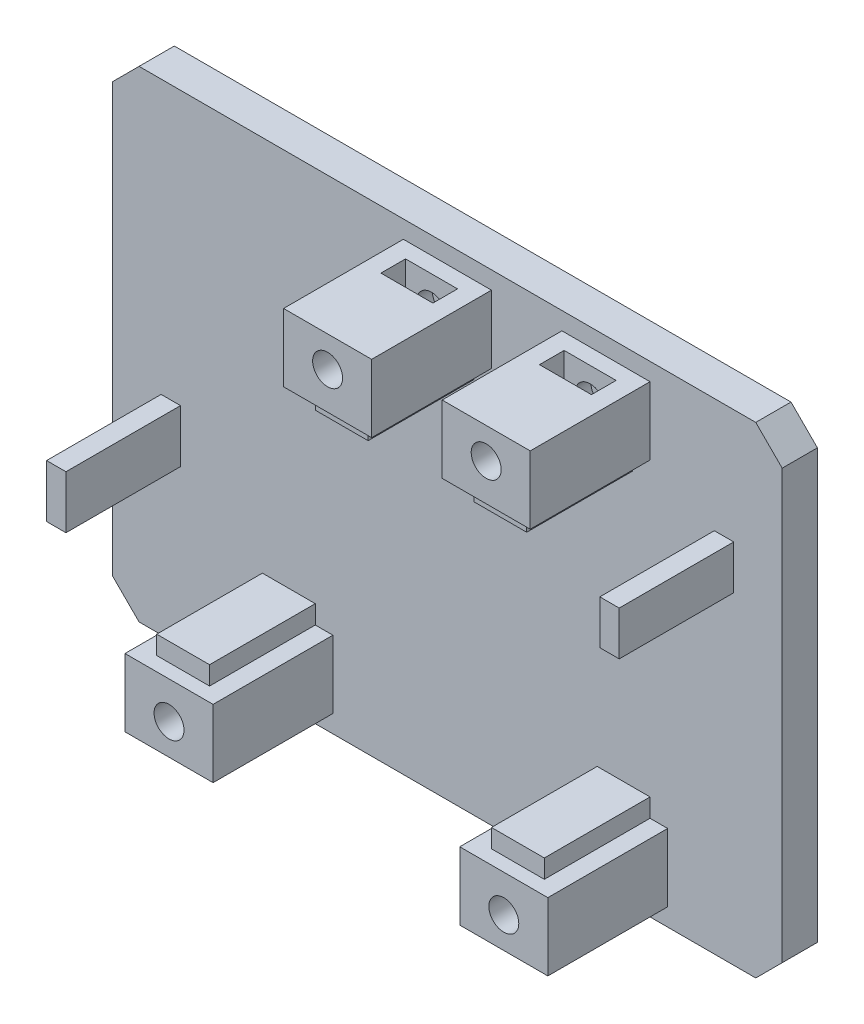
SolidWorks part; units mm, degrees
ref_plane "前视基准面" through (0, 0, 0) normal (0, 0, 1) x (1, 0, 0)
ref_plane "上视基准面" through (0, 0, 0) normal (0, 1, 0) x (1, 0, 0)
ref_plane "右视基准面" through (0, 0, 0) normal (1, 0, 0) x (0, 0, -1)
other "Configuration Table"
sketch "草图1" plane through (0, 0, 0) normal (0, 0, 1) x (1, 0, 0)
  line L0 (-5, -44.619) -> (65, -44.619)
  line L1 (65, -44.619) -> (68, -41.619)
  line L2 (68, -41.619) -> (68, 7)
  line L3 (68, 7) -> (65, 10)
  line L4 (65, 10) -> (-5, 10)
  line L5 (-5, 10) -> (-8, 7)
  line L6 (-8, 7) -> (-8, -41.619)
  line L7 (-8, -41.619) -> (-5, -44.619)
  dimension "D1" = 65
  dimension "D2" = 68
  dimension "D3" = 5
  dimension "D4" = 7
  dimension "D5" = 10
  dimension "D6" = 41.619
extrude "Flat_floor_4mm" add sketch "草图1" along normal blind 4
sketch "草图2" plane through (0, 0, 0) normal (0, 0, 1) x (1, 0, 0)
  line L0 (25, 0.3) -> (35, 0.3)
  line L1 (35, 0.3) -> (35, 8)
  line L2 (35, 8) -> (25, 8)
  line L3 (25, 8) -> (25, 0.3)
  circle A0 centre (30, 4.5) radius 1.7
  dimension "D1" = 3.4
  dimension "D2" = 25
  dimension "D3" = 30
  dimension "D4" = 35
  dimension "D5" = 0.3
  dimension "D6" = 4.5
  dimension "D7" = 8
extrude "Edge_pedestal_1_band_1" add sketch "草图2" along normal blind 1.8 from offset 4
sketch "草图3" plane through (0, 0, 0) normal (0, 0, 1) x (1, 0, 0)
  line L0 (25, 0.3) -> (35, 0.3)
  line L1 (35, 0.3) -> (35, 8)
  line L2 (35, 8) -> (32.95, 8)
  line L3 (32.95, 8) -> (32.95, 1)
  line L4 (32.95, 1) -> (27.05, 1)
  line L5 (27.05, 1) -> (27.05, 8)
  line L6 (27.05, 8) -> (25, 8)
  line L7 (25, 8) -> (25, 0.3)
  dimension "D1" = 25
  dimension "D2" = 27.05
  dimension "D3" = 32.95
  dimension "D4" = 0.3
  dimension "D5" = 1
  dimension "D6" = 8
extrude "Edge_pedestal_1_band_2" add sketch "草图3" along normal blind 2.8 from offset 5.8
sketch "草图4" plane through (0, 0, 0) normal (0, 0, 1) x (1, 0, 0)
  line L0 (25, 0.3) -> (35, 0.3)
  line L1 (35, 0.3) -> (35, 8)
  line L2 (35, 8) -> (25, 8)
  line L3 (25, 8) -> (25, 0.3)
  circle A0 centre (30, 4.5) radius 1.7
  dimension "D1" = 3.4
  dimension "D2" = 25
  dimension "D3" = 30
  dimension "D4" = 35
  dimension "D5" = 0.3
  dimension "D6" = 4.5
  dimension "D7" = 8
extrude "Edge_pedestal_1_band_3" add sketch "草图4" along normal blind 9 from offset 8.6
sketch "草图5" plane through (0, 0, 0) normal (0, 0, 1) x (1, 0, 0)
  line L0 (43, 0.3) -> (53, 0.3)
  line L1 (53, 0.3) -> (53, 8)
  line L2 (53, 8) -> (43, 8)
  line L3 (43, 8) -> (43, 0.3)
  circle A0 centre (48, 4.5) radius 1.7
  dimension "D1" = 3.4
  dimension "D2" = 43
  dimension "D3" = 48
  dimension "D4" = 53
  dimension "D5" = 0.3
  dimension "D6" = 4.5
  dimension "D7" = 8
extrude "Edge_pedestal_2_band_1" add sketch "草图5" along normal blind 1.8 from offset 4
sketch "草图6" plane through (0, 0, 0) normal (0, 0, 1) x (1, 0, 0)
  line L0 (43, 0.3) -> (53, 0.3)
  line L1 (53, 0.3) -> (53, 8)
  line L2 (53, 8) -> (50.95, 8)
  line L3 (50.95, 8) -> (50.95, 1)
  line L4 (50.95, 1) -> (45.05, 1)
  line L5 (45.05, 1) -> (45.05, 8)
  line L6 (45.05, 8) -> (43, 8)
  line L7 (43, 8) -> (43, 0.3)
  dimension "D1" = 43
  dimension "D2" = 45.05
  dimension "D3" = 50.95
  dimension "D4" = 0.3
  dimension "D5" = 1
  dimension "D6" = 8
extrude "Edge_pedestal_2_band_2" add sketch "草图6" along normal blind 2.8 from offset 5.8
sketch "草图7" plane through (0, 0, 0) normal (0, 0, 1) x (1, 0, 0)
  line L0 (43, 0.3) -> (53, 0.3)
  line L1 (53, 0.3) -> (53, 8)
  line L2 (53, 8) -> (43, 8)
  line L3 (43, 8) -> (43, 0.3)
  circle A0 centre (48, 4.5) radius 1.7
  dimension "D1" = 3.4
  dimension "D2" = 43
  dimension "D3" = 48
  dimension "D4" = 53
  dimension "D5" = 0.3
  dimension "D6" = 4.5
  dimension "D7" = 8
extrude "Edge_pedestal_2_band_3" add sketch "草图7" along normal blind 9 from offset 8.6
sketch "草图8" plane through (0, 0, 0) normal (0, 0, 1) x (1, 0, 0)
  line L0 (7, -34.919) -> (17, -34.919)
  line L1 (17, -34.919) -> (17, -42.619)
  line L2 (17, -42.619) -> (7, -42.619)
  line L3 (7, -42.619) -> (7, -34.919)
  circle A0 centre (12, -39.119) radius 1.7
  dimension "D1" = 3.4
  dimension "D2" = 7
  dimension "D3" = 12
  dimension "D4" = 17
  dimension "D5" = 34.919
  dimension "D6" = 39.119
  dimension "D7" = 42.619
extrude "Edge_pedestal_3_band_1" add sketch "草图8" along normal blind 1.8 from offset 4
sketch "草图9" plane through (0, 0, 0) normal (0, 0, 1) x (1, 0, 0)
  line L0 (7, -34.919) -> (17, -34.919)
  line L1 (17, -34.919) -> (17, -42.619)
  line L2 (17, -42.619) -> (14.95, -42.619)
  line L3 (14.95, -42.619) -> (14.95, -35.619)
  line L4 (14.95, -35.619) -> (9.05, -35.619)
  line L5 (9.05, -35.619) -> (9.05, -42.619)
  line L6 (9.05, -42.619) -> (7, -42.619)
  line L7 (7, -42.619) -> (7, -34.919)
  dimension "D1" = 7
  dimension "D2" = 9.05
  dimension "D3" = 14.95
  dimension "D4" = 34.919
  dimension "D5" = 35.619
  dimension "D6" = 42.619
extrude "Edge_pedestal_3_band_2" add sketch "草图9" along normal blind 2.8 from offset 5.8
sketch "草图10" plane through (0, 0, 0) normal (0, 0, 1) x (1, 0, 0)
  line L0 (7, -34.919) -> (17, -34.919)
  line L1 (17, -34.919) -> (17, -42.619)
  line L2 (17, -42.619) -> (7, -42.619)
  line L3 (7, -42.619) -> (7, -34.919)
  circle A0 centre (12, -39.119) radius 1.7
  dimension "D1" = 3.4
  dimension "D2" = 7
  dimension "D3" = 12
  dimension "D4" = 17
  dimension "D5" = 34.919
  dimension "D6" = 39.119
  dimension "D7" = 42.619
extrude "Edge_pedestal_3_band_3" add sketch "草图10" along normal blind 9 from offset 8.6
sketch "草图11" plane through (0, 0, 0) normal (0, 0, 1) x (1, 0, 0)
  line L0 (45, -34.919) -> (55, -34.919)
  line L1 (55, -34.919) -> (55, -42.619)
  line L2 (55, -42.619) -> (45, -42.619)
  line L3 (45, -42.619) -> (45, -34.919)
  circle A0 centre (50, -39.119) radius 1.7
  dimension "D1" = 3.4
  dimension "D2" = 45
  dimension "D3" = 50
  dimension "D4" = 55
  dimension "D5" = 34.919
  dimension "D6" = 39.119
  dimension "D7" = 42.619
extrude "Edge_pedestal_4_band_1" add sketch "草图11" along normal blind 1.8 from offset 4
sketch "草图12" plane through (0, 0, 0) normal (0, 0, 1) x (1, 0, 0)
  line L0 (45, -34.919) -> (55, -34.919)
  line L1 (55, -34.919) -> (55, -42.619)
  line L2 (55, -42.619) -> (52.95, -42.619)
  line L3 (52.95, -42.619) -> (52.95, -35.619)
  line L4 (52.95, -35.619) -> (47.05, -35.619)
  line L5 (47.05, -35.619) -> (47.05, -42.619)
  line L6 (47.05, -42.619) -> (45, -42.619)
  line L7 (45, -42.619) -> (45, -34.919)
  dimension "D1" = 45
  dimension "D2" = 47.05
  dimension "D3" = 52.95
  dimension "D4" = 34.919
  dimension "D5" = 35.619
  dimension "D6" = 42.619
extrude "Edge_pedestal_4_band_2" add sketch "草图12" along normal blind 2.8 from offset 5.8
sketch "草图13" plane through (0, 0, 0) normal (0, 0, 1) x (1, 0, 0)
  line L0 (45, -34.919) -> (55, -34.919)
  line L1 (55, -34.919) -> (55, -42.619)
  line L2 (55, -42.619) -> (45, -42.619)
  line L3 (45, -42.619) -> (45, -34.919)
  circle A0 centre (50, -39.119) radius 1.7
  dimension "D1" = 3.4
  dimension "D2" = 45
  dimension "D3" = 50
  dimension "D4" = 55
  dimension "D5" = 34.919
  dimension "D6" = 39.119
  dimension "D7" = 42.619
extrude "Edge_pedestal_4_band_3" add sketch "草图13" along normal blind 9 from offset 8.6
sketch "草图14" plane through (0, 0, 0) normal (0, 0, 1) x (1, 0, 0)
  line L0 (27, -1.8) -> (33, -1.8)
  line L1 (33, -1.8) -> (33, 0.6)
  line L2 (33, 0.6) -> (27, 0.6)
  line L3 (27, 0.6) -> (27, -1.8)
  line L4 (45, -1.8) -> (51, -1.8)
  line L5 (51, -1.8) -> (51, 0.6)
  line L6 (51, 0.6) -> (45, 0.6)
  line L7 (45, 0.6) -> (45, -1.8)
  line L8 (9, -35.219) -> (15, -35.219)
  line L9 (15, -35.219) -> (15, -32.819)
  line L10 (15, -32.819) -> (9, -32.819)
  line L11 (9, -32.819) -> (9, -35.219)
  line L12 (47, -35.219) -> (53, -35.219)
  line L13 (53, -35.219) -> (53, -32.819)
  line L14 (53, -32.819) -> (47, -32.819)
  line L15 (47, -32.819) -> (47, -35.219)
  dimension "D1" = 9
  dimension "D2" = 15
  dimension "D3" = 27
  dimension "D4" = 45
  dimension "D5" = 47
  dimension "D6" = 0.6
  dimension "D7" = 1.8
  dimension "D8" = 32.819
extrude "Four_component_free_edge_supports" add sketch "草图14" along normal blind 12 from offset 4
sketch "草图15" plane through (0, 0, 0) normal (0, 0, 1) x (1, 0, 0)
  line L0 (-2.5, -27) -> (-0.3, -27)
  line L1 (-0.3, -27) -> (-0.3, -21)
  line L2 (-0.3, -21) -> (-2.5, -21)
  line L3 (-2.5, -21) -> (-2.5, -27)
  line L4 (60.3, -8) -> (62.5, -8)
  line L5 (62.5, -8) -> (62.5, -3)
  line L6 (62.5, -3) -> (60.3, -3)
  line L7 (60.3, -3) -> (60.3, -8)
  dimension "D1" = 60.3
  dimension "D2" = 62.5
  dimension "D3" = 0.3
  dimension "D4" = 3
  dimension "D5" = 8
  dimension "D6" = 21
  dimension "D7" = 27
extrude "Low_side_stops_outside_PCB" add sketch "草图15" along normal blind 13 from offset 4
